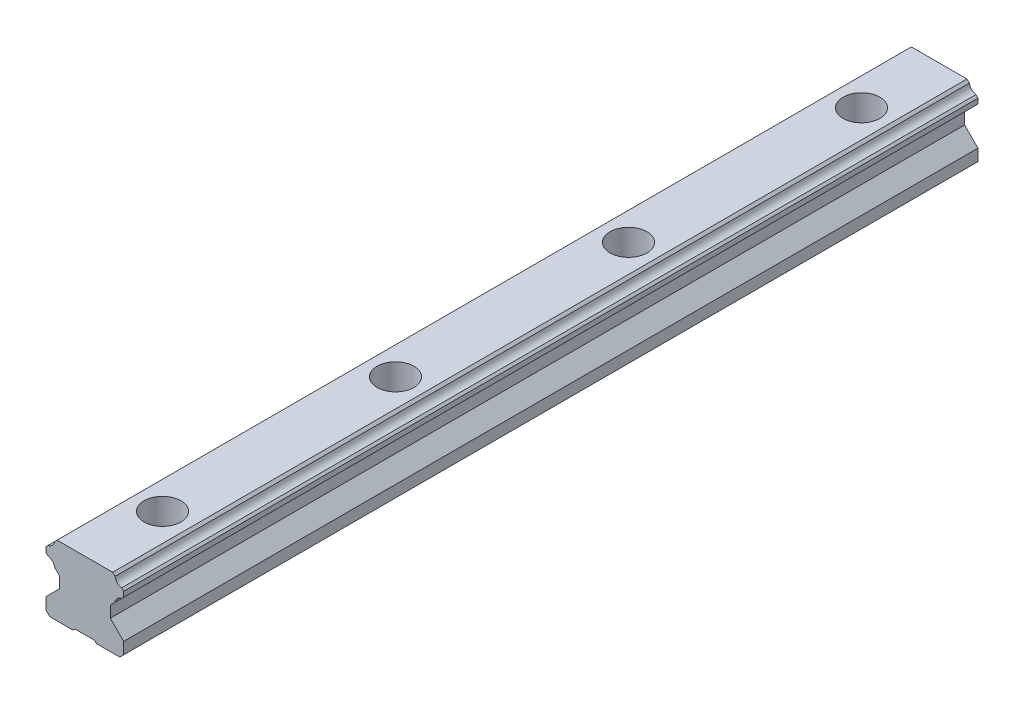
SolidWorks part; units mm, degrees
ref_plane "Front Plane" through (0, 0, 0) normal (0, 0, 1) x (1, 0, 0)
ref_plane "Top Plane" through (0, 0, 0) normal (0, 1, 0) x (1, 0, 0)
ref_plane "Right Plane" through (0, 0, 0) normal (1, 0, 0) x (0, 0, -1)
sketch "Sketch1" plane through (0, 0, 0) normal (0, 0, 1) x (1, 0, 0)
  line L0 (-6.55, 10.3792) -> (-7.7659, 11.5951)
  line L1 (-6.55, 10.3792) -> (-6.55, 7.45)
  line L2 (-6.55, 7.45) -> (-10, 4.0001)
  line L3 (-10, 4.0001) -> (-10, 1)
  line L4 (-9, 0) -> (-10, 1)
  line L5 (-9, 0) -> (-3, 0)
  line L6 (-2.5, 0.5) -> (-3, 0)
  line L7 (-2.5, 0.5) -> (2.5, 0.5)
  line L8 (3, 0) -> (2.5, 0.5)
  line L9 (3, 0) -> (9, 0)
  line L10 (10, 1) -> (9, 0)
  line L11 (10, 1) -> (10, 4.0001)
  line L12 (10, 4.0001) -> (6.55, 7.45)
  line L13 (6.55, 7.45) -> (6.55, 10.3792)
  line L14 (7.7659, 11.5951) -> (6.55, 10.3792)
  line L15 (10, 13.8292) -> (9.4852, 13.3144)
  line L16 (10, 15.16) -> (10, 13.8292)
  line L17 (9.4727, 15.6874) -> (10, 15.16)
  line L18 (7.16, 18) -> (7.7679, 17.3921)
  line L19 (-7.16, 18) -> (7.16, 18)
  line L20 (-7.7679, 17.3921) -> (-7.16, 18)
  line L21 (-10, 15.16) -> (-9.4727, 15.6874)
  line L22 (-10, 13.8292) -> (-10, 15.16)
  line L23 (-9.4852, 13.3144) -> (-10, 13.8292)
  arc A0 (9.4852, 13.3144) -> (7.7659, 11.5951) centre (9.8015, 11.2788) ccw
  arc A1 (7.7679, 17.3921) -> (9.4727, 15.6874) centre (9.8015, 17.7209) ccw
  arc A2 (-9.4727, 15.6874) -> (-7.7679, 17.3921) centre (-9.8015, 17.7209) ccw
  arc A3 (-7.7659, 11.5951) -> (-9.4852, 13.3144) centre (-9.8015, 11.2788) ccw
extrude "Boss-Extrude1" add sketch "Sketch1" along normal mid plane 220
hole_wizard "CBORE for M4 Hex Socket Head Cap Screw1" positions "Sketch2" profile "Sketch3" counterbore size "M4" standard "DIN"
sketch "Sketch2" plane through (0, 18, 0) normal (0, 1, 0) x (1, 0, 0)
  line L1 (7.16, -110) -> (-7.16, -110) construction
  point P0 (0, -90)
  dimension "D1" = 20
sketch "Sketch3" plane through (0, 18, 90) normal (1, 0, 0) x (0, 0, 1)
  line L0 (0, 0) -> (0, 18)
  line L1 (0, 18) -> (3, 18)
  line L3 (3, 18) -> (3, 8.5)
  line L4 (3, 8.5) -> (4.75, 8.5)
  line L5 (4.75, 8.5) -> (4.75, 0)
  line L7 (4.75, 0) -> (0, 0)
  line L11 (0, -6.35) -> (0, 107.95) construction
  dimension "Thru Hole Dia." = 6
  dimension "Thru Hole Depth" = 18
  dimension "C'Bore Dia." = 9.5
  dimension "C'Bore Depth" = 8.5
pattern_linear "LPattern1" count 4 spacing 60 along (0, 0, -1) of "CBORE for M4 Hex Socket Head Cap Screw1"
